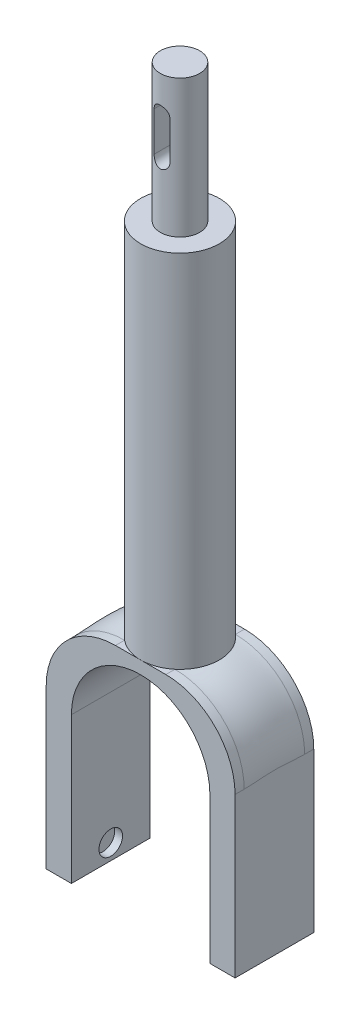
SolidWorks part; units mm, degrees
ref_plane "Front Plane" through (0, 0, 0) normal (0, 0, 1) x (1, 0, 0)
ref_plane "Top Plane" through (0, 0, 0) normal (0, 1, 0) x (1, 0, 0)
ref_plane "Right Plane" through (0, 0, 0) normal (1, 0, 0) x (0, 0, -1)
sketch "Sketch1" plane through (0, 0, 0) normal (0, 1, 0) x (1, 0, 0)
  circle A0 centre (0, 0) radius 6.35
  dimension "D1" = 12.7
extrude "Boss-Extrude1" add sketch "Sketch1" along normal blind 58.1812
sketch "Sketch2" plane through (0, 0, 0) normal (0, -1, 0) x (-1, 0, 0)
  line L1 (15.24, 6.35) -> (-15.24, 6.35)
  line L2 (15.24, 6.35) -> (15.24, -6.35)
  line L3 (15.24, -6.35) -> (-15.24, -6.35)
  line L4 (-15.24, 6.35) -> (-15.24, -6.35)
  line L5 (15.24, 6.35) -> (-15.24, -6.35) construction
  line L6 (15.24, -6.35) -> (-15.24, 6.35) construction
  point P0 (0, 0)
  dimension "D1" = 30.48
  dimension "D2" = 12.7
extrude "Boss-Extrude2" add sketch "Sketch2" along normal blind 36.83
sketch "Sketch5" plane through (0, 0, 6.35) normal (0, 0, 1) x (1, 0, 0)
  line L0 (15.24, -36.83) -> (-15.24, -36.83) construction
  line L1 (-11.176, -36.83) -> (11.176, -36.83)
  line L2 (-11.176, -36.83) -> (-11.176, -13.2334)
  line L3 (-11.176, -13.2334) -> (11.176, -13.2334)
  line L4 (11.176, -36.83) -> (11.176, -13.2334)
  line L5 (15.24, -36.83) -> (15.24, 0) construction
  arc A0 (-11.176, -13.2334) -> (11.176, -13.2334) centre (0, -13.2334) cw
  dimension "D3" = 23.5966
  dimension "D1" = 22.352
  dimension "D2" = 15.24
extrude "Cut-Extrude1" cut sketch "Sketch5" against normal through all contours L4 L3 L2 M8 | A0 L3
sketch "Sketch6" plane through (-11.176, 0, 0) normal (1, 0, 0) x (0, 0, -1)
  line L0 (-6.35, -36.83) -> (-6.35, -13.2334) construction
  line L1 (-6.35, 0) -> (6.35, 0) construction
  circle A0 centre (0, -34.29) radius 1.905
  point P4 (0, -34.29)
  dimension "D1" = 3.81
  dimension "D2" = 34.29
  dimension "D3" = 6.35
fillet "Fillet1" radius 11.176 1 edges at (15.24, 0, 0)
fillet "Fillet2" radius 11.176 1 edges at (-15.24, 0, 0)
sketch "Sketch9" plane through (0, 58.1812, 0) normal (0, 1, 0) x (1, 0, 0)
  circle A0 centre (0, 0) radius 3.175
  dimension "D1" = 6.35
extrude "Boss-Extrude4" add sketch "Sketch9" along normal blind 22.225
sketch "Sketch10" plane through (0, 0, 0) normal (0, 0, 1) x (1, 0, 0)
  line L0 (6.35, 58.1812) -> (-6.35, 58.1812) construction
  line L1 (-3.175, 80.4062) -> (-3.175, 58.1812) construction
  circle A0 centre (0, 68.3412) radius 1.27
  dimension "D1" = 2.54
  dimension "D2" = 10.16
  dimension "D3" = 3.175
extrude "Cut-Extrude2" cut sketch "Sketch10" against normal through all both and the other way through all
sketch "Sketch11" plane through (0, 0, 0) normal (0, 0, 1) x (1, 0, 0)
  line L0 (3.175, 58.1812) -> (3.175, 80.4062) construction
  circle A0 centre (0, 74.6912) radius 1.27
  circle A1 centre (0, 68.3412) radius 1.27 construction
  dimension "D1" = 2.54
  dimension "D2" = 6.35
  dimension "D3" = 3.175
extrude "Cut-Extrude3" cut sketch "Sketch11" against normal through all both and the other way through all
sketch "Sketch12" plane through (0, 0, 0) normal (0, 0, 1) x (1, 0, 0)
  line L1 (1.27, 68.3412) -> (-1.27, 68.3412)
  line L2 (1.27, 68.3412) -> (1.27, 74.6912)
  line L3 (1.27, 74.6912) -> (-1.27, 74.6912)
  line L4 (-1.27, 68.3412) -> (-1.27, 74.6912)
  line L5 (1.27, 68.3412) -> (-1.27, 74.6912) construction
  line L6 (1.27, 74.6912) -> (-1.27, 68.3412) construction
  circle A0 centre (0, 74.6912) radius 1.27 construction
  point P0 (0, 71.5162)
  dimension "D1" = 3.175
  dimension "D2" = 2.54
  dimension "D3" = 6.35
extrude "Cut-Extrude4" cut sketch "Sketch12" against normal through all both and the other way through all
extrude "Cut-Extrude5" cut sketch "Sketch6" against normal blind 1.27
sketch "Sketch13" plane through (11.176, 0, 0) normal (-1, 0, 0) x (0, 0, 1)
  line L0 (6.35, -36.83) -> (6.35, -13.2334) construction
  line L2 (6.35, 0) -> (4.8792, 0) construction
  circle A0 centre (0, -34.29) radius 1.905
  dimension "D3" = 3.81
  dimension "D1" = 6.35
  dimension "D2" = 34.29
extrude "Cut-Extrude6" cut sketch "Sketch13" against normal blind 1.27
